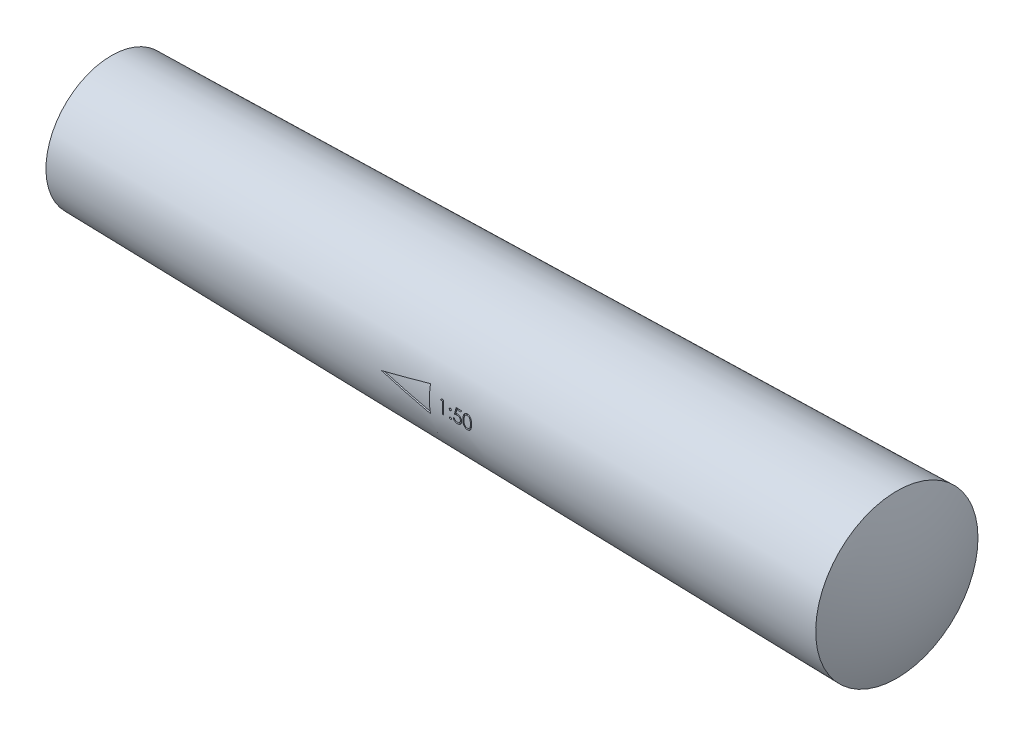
SolidWorks part; units mm, degrees
ref_plane "Front Plane" through (0, 0, 0) normal (0, 0, 1) x (1, 0, 0)
ref_plane "Top Plane" through (0, 0, 0) normal (0, 1, 0) x (1, 0, 0)
ref_plane "Right Plane" through (0, 0, 0) normal (1, 0, 0) x (0, 0, -1)
sketch "Sketch1" plane through (0, 0, 0) normal (1, 0, 0) x (0, 0, -1)
  circle A0 centre (0, 0) radius 5
  dimension "D1" = 10
extrude "Extrude1" add sketch "Sketch1" along normal mid plane 60
draft "Draft1" type of draft neutral plane draft angle 1.146 faces to draft 1 parameters "D1"=1.146
sketch "Sketch2" plane through (0, 0, 0) normal (0, 0, 1) x (1, 0, 0)
  line L0 (-30, 0) -> (-30, 5)
  line L1 (-30, 5) -> (-30, -5) construction
  line L2 (-30, 0) -> (-31.2, 0)
  line L3 (-31.2, 0) -> (-31.2, -5.6) construction
  line L4 (30, 0) -> (30, 6.2)
  line L5 (30, -6.2) -> (30, 6.2) construction
  line L6 (30, 0) -> (31.2, 0)
  line L7 (31.2, 0) -> (31.2, -5.6) construction
  line L8 (-30, -5) -> (30, -6.2) construction
  arc A0 (-31.2, 0) -> (-30, 5) centre (-20.1833, 0) cw
  arc A1 (31.2, 0) -> (30, 6.2) centre (14.5831, 0) ccw
  point P14 (0, -5.6)
revolve "Revolve1" add sketch "Sketch2" angle 360 about L2
sketch "Sketch5" plane through (0, 0, 0) normal (0, 0, 1) x (1, 0, 0)
  line L0 (0, 5.6) -> (0, -5.6) construction
  line L1 (30, 6.2) -> (-30, 5) construction
  line L2 (-30, -5) -> (30, -6.2) construction
ref_plane "Plane2" through (0, 0, 0) normal (-0.02, 0, 0.9998) x (0.9998, 0, 0.02)
sketch "Sketch6" plane through (0, 0, 0) normal (-0.02, 0, 0.9998) x (0.9998, 0, 0.02)
  line L0 (0, 0) -> (0, 1)
  line L1 (0, 5.6) -> (0, -5.6) construction
  line L2 (0, 1) -> (-3.7321, 0)
  line L3 (-3.7321, 0) -> (0, -1)
  line L4 (0, -1) -> (0, 0)
  line L5 (0, -0.5) -> (4, -0.5) construction
  text T0 "1:50" font "Century Gothic" height 1
  dimension "D1" = 2
  dimension "D2" = 30
  dimension "D3" = 4
wrap "Wrap2" sketch "Sketch6" wrap type deboss source sketch "Sketch6" thickness 0.1 parameters "D1"=0.1
equation "\"D2@Sketch2\" = \"D1@Sketch2\""
